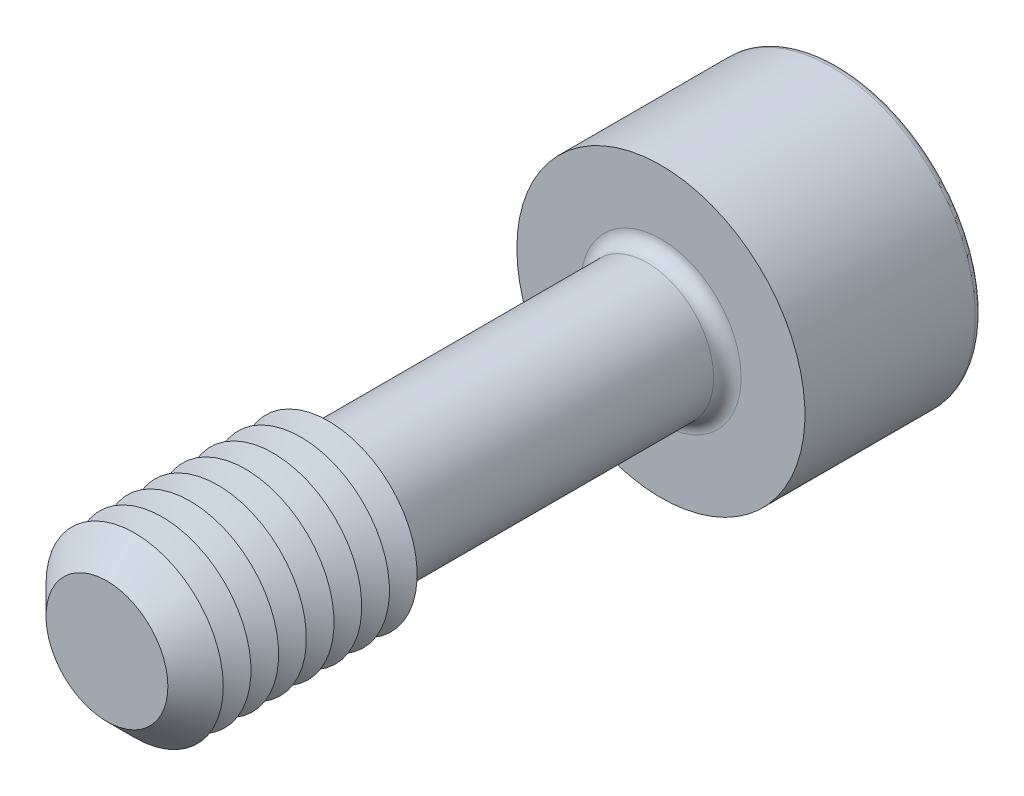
SolidWorks part; units mm, degrees
ref_plane "Front Plane" through (0, 0, 0) normal (0, 0, 1) x (1, 0, 0)
ref_plane "Top Plane" through (0, 0, 0) normal (0, 1, 0) x (1, 0, 0)
ref_plane "Right Plane" through (0, 0, 0) normal (1, 0, 0) x (0, 0, -1)
sketch "Sketch1" plane through (0, 0, 0) normal (0, 0, 1) x (1, 0, 0)
  circle A0 centre (0, 0) radius 3
  dimension "D1" = 6
extrude "Extrude1" add sketch "Sketch1" along normal mid plane 25
sketch "Sketch2" plane through (0, 0, 0) normal (1, 0, 0) x (0, 0, -1)
  line L0 (-12.5, 0) -> (-12.5, 4)
  line L1 (-12.5, 3) -> (-12.5, -3) construction
  line L2 (-12.5, 4) -> (-2.5, 4)
  line L3 (-2.5, 4) -> (-1.9226, 3)
  line L4 (12.5, 3) -> (-12.5, 3) construction
  line L5 (-1.9226, 3) -> (-1.9226, 0)
  line L6 (-1.9226, 0) -> (-12.5, 0)
  dimension "D1" = 4
  dimension "D2" = 120
  dimension "D3" = 10
revolve "Revolve1" add sketch "Sketch2" angle 360 about L6
chamfer "Chamfer1" distance 1.25 angle 45 1 edges at (0, 4, 12.5)
sketch "Sketch3" plane through (0, 0, -12.5) normal (0, 0, -1) x (-1, 0, 0)
  circle A0 centre (0, 0) radius 6.5
  dimension "D1" = 13
extrude "Extrude2" add sketch "Sketch3" along normal blind 8
sketch "Sketch4" plane through (-13.7, 0, -20.5) normal (0, 0, 1) x (1, 0, 0)
  line L2 (11.9679, -3) -> (15.4321, -3)
  line L3 (15.4321, -3) -> (17.1641, 0)
  line L4 (17.1641, 0) -> (15.4321, 3)
  line L6 (15.4321, 3) -> (11.9679, 3)
  line L7 (11.9679, 3) -> (10.2359, 0)
  line L8 (10.2359, 0) -> (11.9679, -3)
  circle A0 centre (13.7, 0) radius 3 construction
  dimension "D1" = 6
extrude "Extrude3" cut sketch "Sketch4" along normal blind 6
fillet "Fillet1" radius 0.62 1 edges at (-3, 0, -12.5)
fillet "Fillet2" radius 0.31 1 edges at (-6.5, 0, -20.5)
sketch "Sketch5" plane through (0, 0, 0) normal (1, 0, 0) x (0, 0, -1)
  line L0 (14.5, 0) -> (14.5, -3)
  line L1 (14.5, -3) -> (12.7679, 0)
  line L2 (12.7679, 0) -> (14.5, 0)
  dimension "D1" = 30
revolve "Cut-Revolve1" cut sketch "Sketch5" angle 360 about L2
sketch "Sketch6" plane through (0, 0, 0) normal (1, 0, 0) x (0, 0, -1)
  line L0 (1.332, 0) -> (-13.289, 0) construction
sketch "Sketch7" plane through (0, 0, 0) normal (1, 0, 0) x (0, 0, -1)
  line L0 (-2.5, 4) -> (-3.125, 2.9175)
  line L1 (-3.125, 2.9175) -> (-3.75, 4)
  line L2 (-2.5, 4) -> (-11.25, 4) construction
  line L3 (-3.75, 4) -> (-2.5, 4)
  dimension "D1" = 1.25
revolve "Cut-Revolve2" cut sketch "Sketch7" angle 360 about L0
pattern_linear "LPattern1" count 7 spacing 1.25 along (0, 0, 1) of "Cut-Revolve2"
